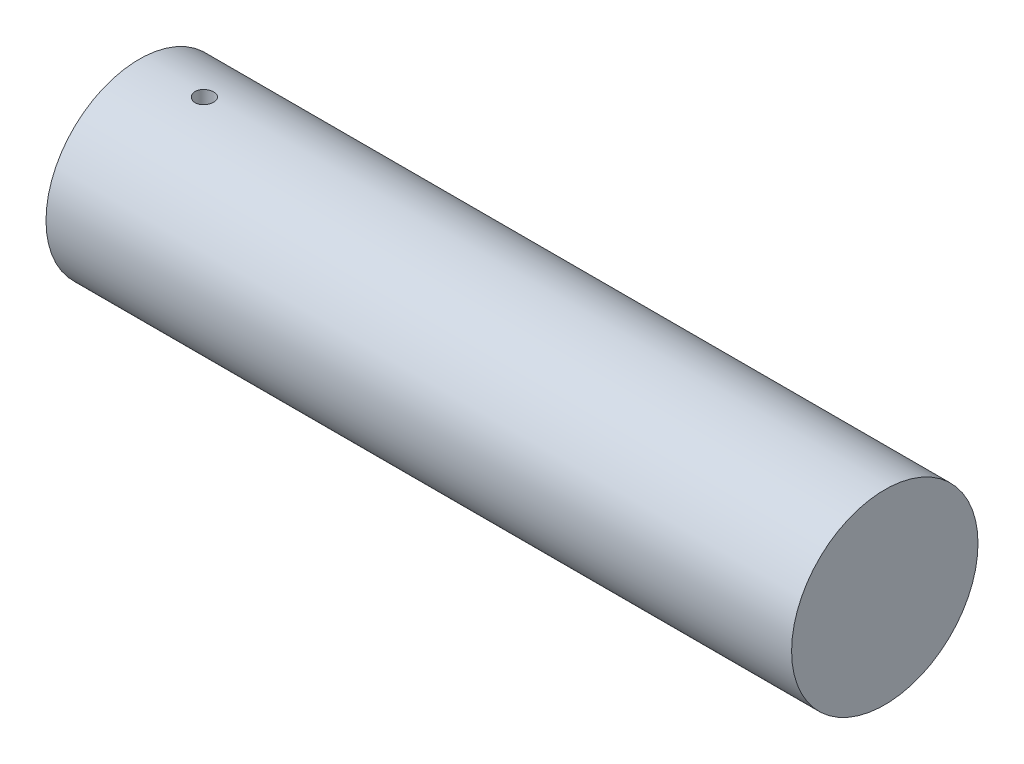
SolidWorks part; units mm, degrees
ref_plane "前视基准面" through (0, 0, 0) normal (0, 0, 1) x (1, 0, 0)
ref_plane "上视基准面" through (0, 0, 0) normal (0, 1, 0) x (1, 0, 0)
ref_plane "右视基准面" through (0, 0, 0) normal (1, 0, 0) x (0, 0, -1)
sketch "草图1" plane through (0, 0, 0) normal (1, 0, 0) x (0, 0, -1)
  circle A0 centre (0, 0) radius 5
  dimension "D1" = 10
extrude "凸台-拉伸1" add sketch "草图1" along normal blind 40
sketch "草图2" plane through (0, 0, 0) normal (0, 1, 0) x (1, 0, 0)
  line L0 (0, 0) -> (3.5, 0) construction
  circle A0 centre (3.5, 0) radius 0.5
  dimension "D1" = 1
  dimension "D2" = 3.5
extrude "切除-拉伸1" cut sketch "草图2" against normal mid plane 40
sketch "草图3" plane through (0, 0, 0) normal (-1, 0, 0) x (0, 0, 1)
  circle A0 centre (0, 0) radius 1.25
  dimension "D1" = 2.5
extrude "切除-拉伸2" cut sketch "草图3" against normal blind 10
